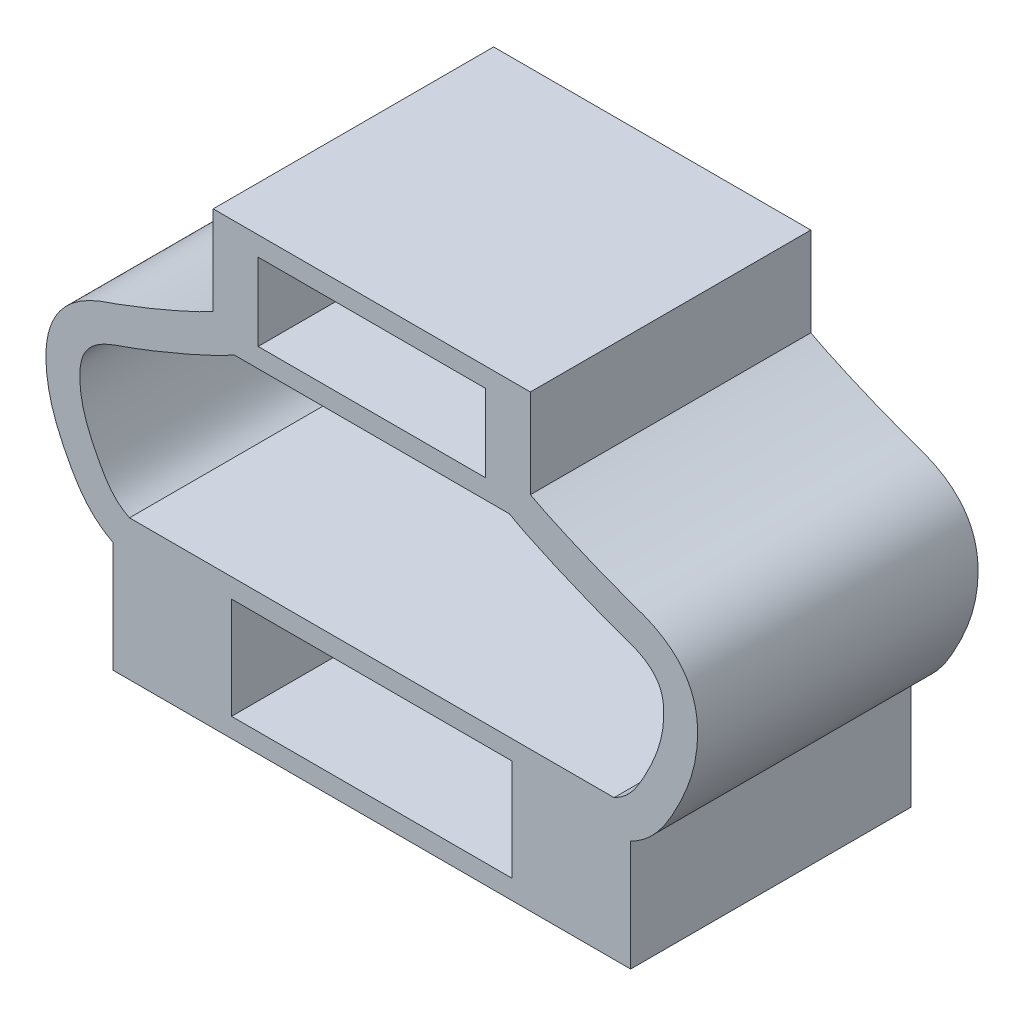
SolidWorks part; units mm, degrees
ref_plane "前视基准面" through (0, 0, 0) normal (0, 0, 1) x (1, 0, 0)
ref_plane "上视基准面" through (0, 0, 0) normal (0, 1, 0) x (1, 0, 0)
ref_plane "右视基准面" through (0, 0, 0) normal (1, 0, 0) x (0, 0, -1)
sketch "Model" plane through (0, 0, 0) normal (0, 0, 1) x (1, 0, 0)
  line L0 (5.0113, 0) -> (0, 0)
  line L1 (2.1613, 4) -> (5.0113, 4)
  line L2 (5.0113, 4) -> (5.0113, 4.4)
  line L3 (5.0113, 4.4) -> (2.6613, 4.4)
  line L4 (2.6613, 4.4) -> (2.6613, 6)
  line L5 (2.6613, 6) -> (5.0113, 6)
  line L6 (5.0113, 6) -> (5.0113, 6.4)
  line L7 (5.0113, 6.4) -> (1.7314, 6.4)
  line L8 (1.7314, 6.4) -> (1.7314, 4.5593)
  line L9 (-0.3426, -0.6104) -> (-0.3426, -2.9)
  line L10 (-0.3426, -2.9) -> (5.0113, -2.9)
  line L11 (5.0113, -2.9) -> (5.0113, -2.5)
  line L12 (5.0113, -2.5) -> (2.1113, -2.5)
  line L13 (2.1113, -2.5) -> (2.1113, -0.4)
  line L14 (2.1113, -0.4) -> (5.0113, -0.4)
  line L15 (5.0113, -0.4) -> (5.0113, 0)
  spline S0 degree 3 number of poles 148 (0, 0) -> (2.1613, 4)
  spline S1 degree 3 number of poles 145 (1.7314, 4.5593) -> (-0.3426, -0.6104)
extrude "凸台-拉伸1" add sketch "Model" along normal blind 5.8
ref_plane "基准面4" through (5.0113, 0, 0) normal (1, 0, 0) x (0, 0, -1)
mirror "镜向1" about plane through (5.0113, 0, 0) normal (1, 0, 0) of "凸台-拉伸1"
